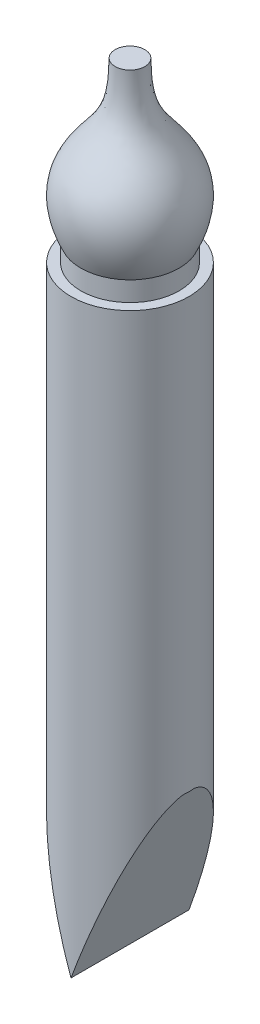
SolidWorks part; units mm, degrees
ref_plane "Спереди" through (0, 0, 0) normal (0, 0, 1) x (1, 0, 0)
ref_plane "Сверху" through (0, 0, 0) normal (0, 1, 0) x (1, 0, 0)
ref_plane "Справа" through (0, 0, 0) normal (1, 0, 0) x (0, 0, -1)
sketch "Эскиз1" plane through (0, 0, 0) normal (0, 0, 1) x (1, 0, 0)
  line L0 (0, 0) -> (3, 0)
  line L1 (3, 0) -> (3, 30)
  line L2 (3, 30) -> (2.5, 30)
  line L3 (0, 39) -> (0, 0)
  line L4 (2.5, 30) -> (2.5, 31)
  line L5 (0.75, 39) -> (0, 39)
  line L6 (0.75, 36.8304) -> (0.75, 39.5097) construction
  spline S0 degree 3 poles (0.75, 39) (0.75, 36.9949) (1.623, 35.8717) (3.6222, 33.3621) (2.5, 31) knots 0 0 0 0 0.491714 1 1 1 1
  dimension "D1" = 3
  dimension "D2" = 30
  dimension "D3" = 0.75
  dimension "D4" = 9
  dimension "D5" = 1
  dimension "D6" = 0.5
revolve "Повернуть1" add sketch "Эскиз1" angle 360 about L3
sketch "Эскиз2" plane through (0, 0, 0) normal (0, 0, 1) x (1, 0, 0)
  line L0 (0, 0) -> (2.9846, 8.2)
  line L1 (0, 0) -> (-2.9846, 8.2)
  line L2 (0, 13.5735) -> (0, -4.8635) construction
  dimension "D1" = 40
  dimension "D2" = 21.8
extrude "Вырез-Вытянуть1" cut sketch "Эскиз2" against normal through all and the other way through all contours L0 L1
